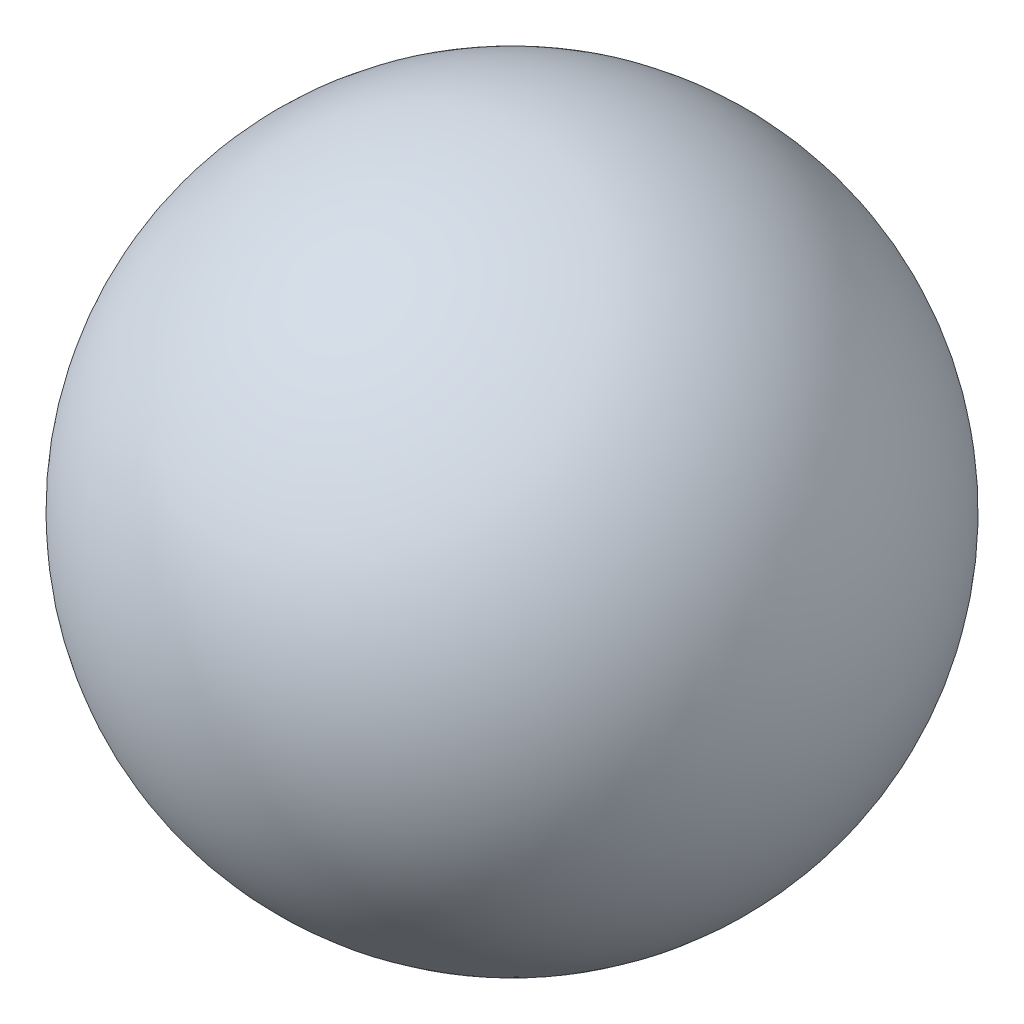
SolidWorks part; units mm, degrees
ref_plane "Front Plane" through (0, 0, 0) normal (0, 0, 1) x (1, 0, 0)
ref_plane "Top Plane" through (0, 0, 0) normal (0, 1, 0) x (1, 0, 0)
ref_plane "Right Plane" through (0, 0, 0) normal (1, 0, 0) x (0, 0, -1)
sketch "Sketch1" plane through (0, 0, 0) normal (0, 0, 1) x (1, 0, 0)
  line L0 (0, 9.5) -> (0, -9.5)
  arc A0 (0, -9.5) -> (0, 9.5) centre (0, 0) ccw
  dimension "D1" = 9.5
revolve "Revolve1" add sketch "Sketch1" angle 360 about L0
ref_plane "Plane1" through (0, -9, 0) normal (0, 1, 0) x (-1, 0, 0)
sketch "Sketch2" plane through (0, -9, 0) normal (0, 1, 0) x (-1, 0, 0)
  line L1 (-5.3713, 3.8202) -> (6.8649, 3.8202)
  line L2 (-5.3713, 3.8202) -> (-5.3713, -4.2224)
  line L3 (-5.3713, -4.2224) -> (6.8649, -4.2224)
  line L4 (6.8649, 3.8202) -> (6.8649, -4.2224)
extrude "Extrude1" cut sketch "Sketch2" against normal blind 10
hole_wizard "M4 Tapped Hole1" positions "3DSketch1" profile "Sketch4" tap size "M4" standard "ISO"
sketch3d "3DSketch1"
  point P0 (0, -9, 0)
  point P3 (0, -9, 0)
sketch "Sketch4" plane through (0, -9, 0) normal (1, 0, 0) x (0, 0, -1)
  line L0 (0, 0) -> (0, 10.9914)
  line L1 (0, 10.9914) -> (1.65, 10)
  line L2 (1.65, 10) -> (1.65, 0)
  line L5 (1.65, 0) -> (0, 0)
  line L10 (0, 10.9914) -> (-1.65, 10) construction
  line L11 (0, -6.35) -> (0, 107.95) construction
  dimension "Tap Drill Dia." = 3.3
  dimension "Tap Drill Depth" = 10
  dimension "Drill Angle" = 118
